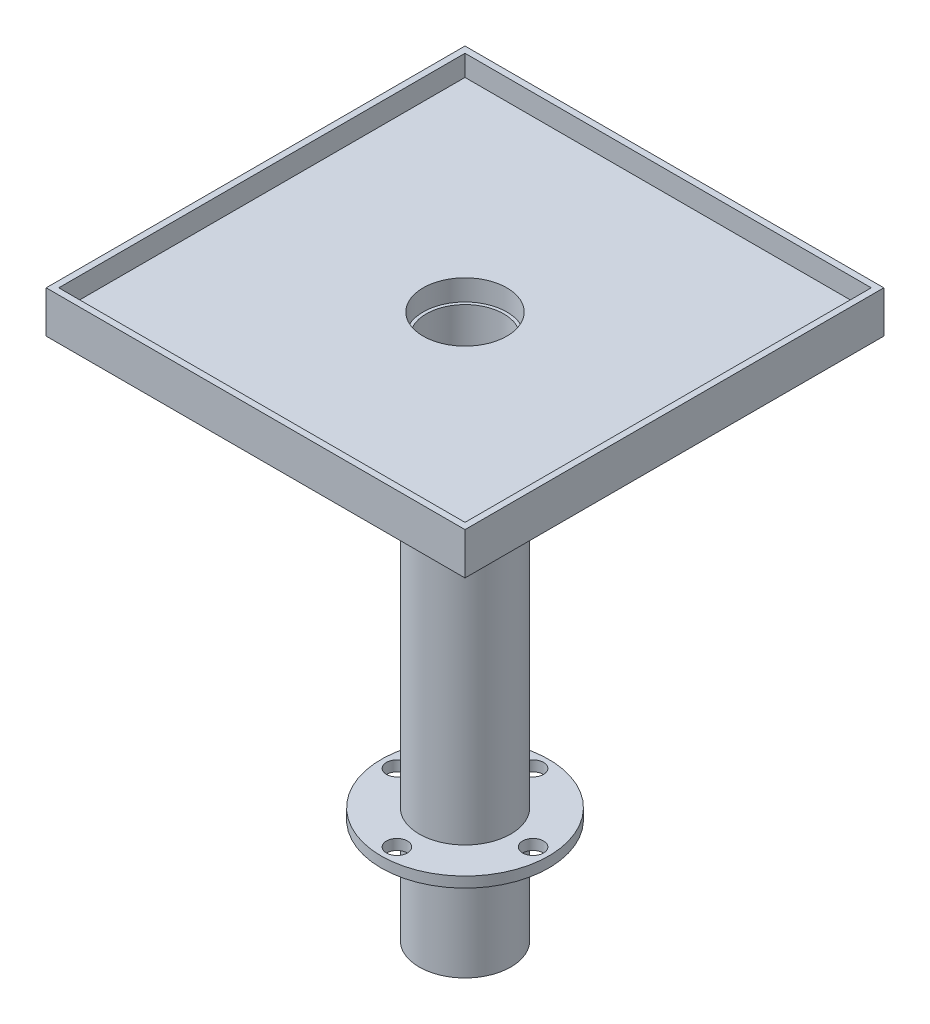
SolidWorks part; units mm, degrees
ref_plane "Front Plane" through (0, 0, 0) normal (0, 0, 1) x (1, 0, 0)
ref_plane "Top Plane" through (0, 0, 0) normal (0, 1, 0) x (1, 0, 0)
ref_plane "Right Plane" through (0, 0, 0) normal (1, 0, 0) x (0, 0, -1)
sketch "Sketch1" plane through (0, 0, 0) normal (0, 1, 0) x (1, 0, 0)
  circle A0 centre (0, 0) radius 5.08
  circle A1 centre (0, 0) radius 10.16
  dimension "D1" = 10.16
  dimension "D2" = 20.32
extrude "Boss-Extrude1" add sketch "Sketch1" along normal blind 1.27 separate body
sketch "Sketch2" plane through (0, 0, 0) normal (0, 1, 0) x (1, 0, 0)
  circle A0 centre (0, 0) radius 5.5517
  circle A1 centre (0, 0) radius 4.699
  dimension "D1" = 0.8527
extrude "Boss-Extrude2" add sketch "Sketch2" along normal blind 50.8 and the other way blind 12.7
ref_plane "Plane1" through (0, 50.8, 0) normal (0, 1, 0) x (1, 0, 0)
sketch "Sketch3" plane through (0, 50.8, 0) normal (0, 1, 0) x (1, 0, 0)
  line L0 (0, 0) -> (0, -11.0812) construction
  line L1 (-25.4, 25.4) -> (25.4, 25.4)
  line L2 (-25.4, 25.4) -> (-25.4, -25.4)
  line L3 (-25.4, -25.4) -> (25.4, -25.4)
  line L4 (25.4, 25.4) -> (25.4, -25.4)
  line L5 (0, 0) -> (-10.381, 0) construction
  circle A2 centre (0, 0) radius 5.08
  point P4 (0, 0)
  dimension "D3" = 10.16
  dimension "D1" = 50.8
  dimension "D2" = 50.8
  dimension "D4" = 25.4
extrude "Boss-Extrude3" add sketch "Sketch3" along normal blind 2.54
sketch "Sketch4" plane through (0, 53.34, 0) normal (0, 1, 0) x (1, 0, 0)
  line L1 (-25.4, 25.4) -> (25.4, 25.4)
  line L2 (-25.4, 25.4) -> (-25.4, -25.4)
  line L3 (-25.4, -25.4) -> (25.4, -25.4)
  line L4 (25.4, 25.4) -> (25.4, -25.4)
  line L5 (-24.638, 24.638) -> (24.638, 24.638)
  line L6 (-24.638, 24.638) -> (-24.638, -24.638)
  line L7 (-24.638, -24.638) -> (24.638, -24.638)
  line L8 (24.638, 24.638) -> (24.638, -24.638)
  circle A0 centre (0, 0) radius 4.699
  dimension "D1" = 0.762
  dimension "D2" = 0.762
  dimension "D3" = 0.762
  dimension "D4" = 0.762
extrude "Boss-Extrude4" add sketch "Sketch4" along normal blind 2.54 contours L5 L8 L7 L6 M13 M10 M11 M12
sketch "Sketch6" plane through (0, 1.27, 0) normal (0, 1, 0) x (1, 0, 0)
  circle A0 centre (0, 8.255) radius 1.27
  circle A1 centre (0, -8.255) radius 1.27
  circle A2 centre (8.255, 0) radius 1.27
  circle A3 centre (-8.255, 0) radius 1.27
  circle A5 centre (0, 0) radius 8.255 construction
  dimension "D1" = 2.54
  dimension "D2" = 16.51
extrude "Cut-Extrude1" cut sketch "Sketch6" against normal through all
